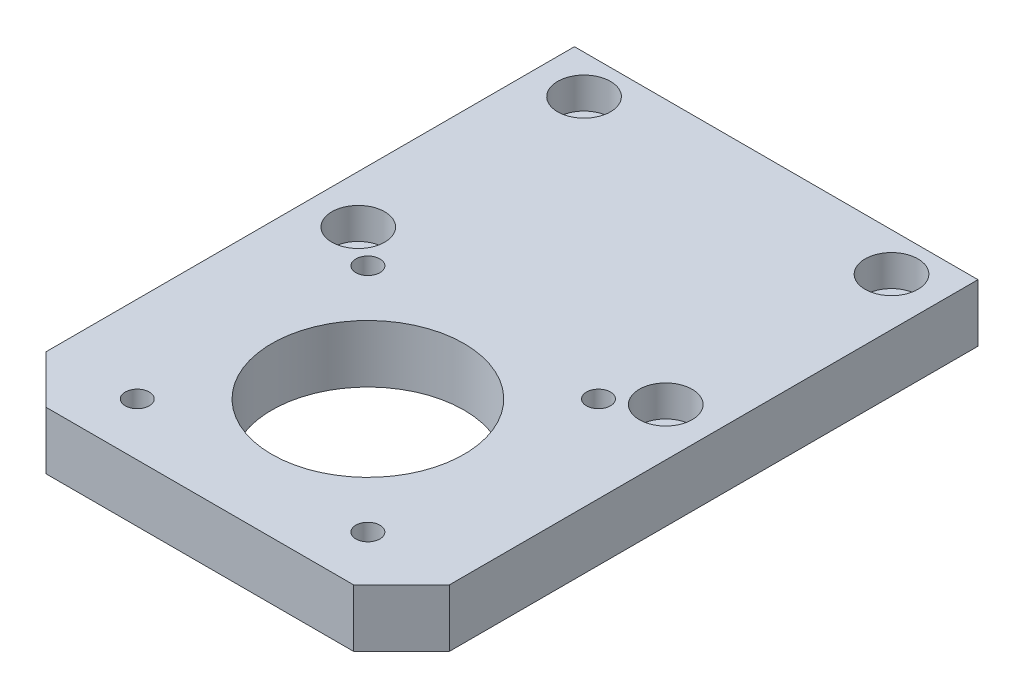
SolidWorks part; units mm, degrees
ref_plane "前视基准面" through (0, 0, 0) normal (0, 0, 1) x (1, 0, 0)
ref_plane "上视基准面" through (0, 0, 0) normal (0, 1, 0) x (1, 0, 0)
ref_plane "右视基准面" through (0, 0, 0) normal (1, 0, 0) x (0, 0, -1)
sketch "草图1" plane through (0, 0, 0) normal (0, 0, 1) x (1, 0, 0)
  line L0 (0, 0) -> (84, 0)
  line L1 (0, 12) -> (84, 12)
  line L2 (0, 0) -> (0, 12)
  line L3 (84, 0) -> (84, 12)
extrude "凸台-拉伸1" add sketch "草图1" along normal blind 120
sketch "草图2" plane through (0, 12, 0) normal (0, 1, 0) x (1, 0, 0)
  line L0 (10, -120) -> (74, -120)
  line L1 (0, 0) -> (84, 0)
  line L2 (0, -110) -> (0, 0)
  line L3 (84, -110) -> (84, 0)
  line L4 (84, -110) -> (74, -120)
  line L5 (10, -120) -> (0, -110)
  circle A0 centre (10, -55) radius 3.25
  circle A1 centre (74, -55) radius 3.25
  circle A2 centre (18, -61) radius 2.5
  circle A3 centre (66, -61) radius 2.5
  circle A4 centre (66, -109) radius 2.5
  circle A5 centre (18, -109) radius 2.5
  circle A6 centre (42, -85) radius 20
  circle A7 centre (74, -8) radius 3.25
  circle A8 centre (10, -8) radius 3.25
extrude "切除-拉伸1" cut sketch "草图2" against normal blind 120 flip side to cut
sketch "草图3" plane through (0, 12, 0) normal (0, 1, 0) x (1, 0, 0)
  circle A0 centre (10, -55) radius 5.5
  circle A1 centre (74, -55) radius 5.5
  circle A2 centre (74, -8) radius 5.5
  circle A3 centre (10, -8) radius 5.5
extrude "切除-拉伸2" cut sketch "草图3" against normal blind 6.5
